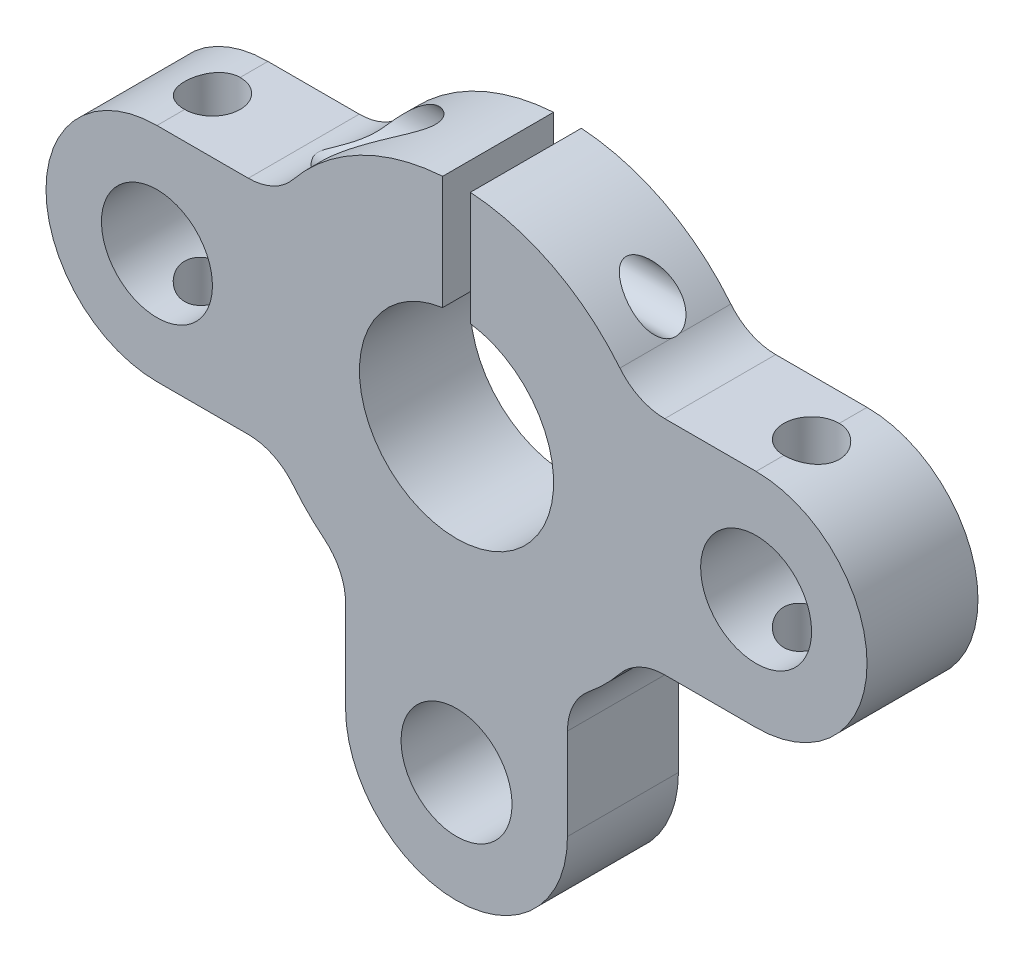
SolidWorks part; units mm, degrees
ref_plane "Front Plane" through (0, 0, 0) normal (0, 0, 1) x (1, 0, 0)
ref_plane "Top Plane" through (0, 0, 0) normal (0, 1, 0) x (1, 0, 0)
ref_plane "Right Plane" through (0, 0, 0) normal (1, 0, 0) x (0, 0, -1)
sketch "Sketch1" plane through (0, 0, 0) normal (0, 0, 1) x (1, 0, 0)
  circle A0 centre (0, 0) radius 11.1125
  circle A1 centre (0, 0) radius 24.0665
  dimension "D1" = 22.225
  dimension "D2" = 12.954
extrude "Boss-Extrude1" add sketch "Sketch1" along normal blind 12.7
sketch "Sketch2" plane through (0, 0, 12.7) normal (0, 0, 1) x (1, 0, 0)
  line L1 (-1.5875, 0) -> (1.5875, 0)
  line L2 (-1.5875, 0) -> (-1.5875, 25.4)
  line L3 (-1.5875, 25.4) -> (1.5875, 25.4)
  line L4 (1.5875, 0) -> (1.5875, 25.4)
  line L5 (-1.5875, 0) -> (1.5875, 25.4) construction
  line L6 (-1.5875, 25.4) -> (1.5875, 0) construction
  point P0 (0, 12.7)
  point P5 (0, 0)
  dimension "D1" = 3.175
  dimension "D2" = 25.4
extrude "Cut-Extrude1" cut sketch "Sketch2" against normal through all
sketch "Sketch7" plane through (0, 0, 0) normal (0, 0, -1) x (-1, 0, 0)
  line L0 (-12.7, -34.29) -> (-12.7, -20.4428)
  line L1 (12.7, -34.29) -> (12.7, -20.4428)
  circle A0 centre (0, 0) radius 34.29 construction
  circle A1 centre (0, -34.29) radius 6.35
  arc A2 (-12.7, -34.29) -> (12.7, -34.29) centre (0, -34.29) ccw
  arc A3 (-1.5875, 24.0141) -> (1.5875, 24.0141) centre (0, 0) ccw construction
  circle A5 centre (0, -34.29) radius 12.7 construction
  spline S0 degree 1 poles (-12.7, -20.4428) (12.7, -20.4428) knots 0 0 1 1
  point P15 (8.89, -30.1625)
  dimension "D1" = 68.58
  dimension "D2" = 12.7
  dimension "D3" = 6.35
extrude "Boss-Extrude4" add sketch "Sketch7" against normal blind 12.7
pattern_circular "CirPattern1" count 2 every 90 about axis through (0, 0, 0) along (0, 0, 1) of "Boss-Extrude4"
pattern_circular "CirPattern2" count 2 every 270 about axis through (0, 0, 0) along (0, 0, 1) of "CirPattern1"
sketch "Sketch8" plane through (0, 12.7, 0) normal (0, 1, 0) x (1, 0, 0)
  line L0 (34.29, -12.7) -> (34.29, 0) construction
  line L1 (20.4428, 0) -> (34.29, 0) construction
  line L2 (0, 0) -> (0, -17.7157) construction
  line L3 (0, -12.7) -> (0, 0) construction
  circle A0 centre (34.29, -6.35) radius 3.175
  circle A1 centre (-34.29, -6.35) radius 3.175
  dimension "D1" = 6.35
  dimension "D2" = 6.35
extrude "Cut-Extrude5" cut sketch "Sketch8" against normal through all
fillet "Fillet1" radius 6.604 6 edges at (-20.4428, 12.7, 6.35) (20.4428, 12.7, 6.35) (20.4428, -12.7, 6.35) (12.7, -20.4428, 6.35) (-20.4428, -12.7, 6.35) (-12.7, -20.4428, 6.35)
sketch "Sketch10" plane through (1.5875, 0, 0) normal (-1, 0, 0) x (0, 0, 1)
  line L0 (0, 24.0141) -> (0, 15.1474) construction
  line L1 (0, 24.0141) -> (12.7, 24.0141) construction
  point P0 (6.35, 17.6641)
  dimension "D1" = 6.35
  dimension "D2" = 6.35
hole_wizard "1/4-20 Tapped Hole1" positions "Sketch11" profile "Sketch12" tap size "1/4-20" standard "ANSI Inch"
sketch "Sketch11" plane through (1.5875, 0, 0) normal (-1, 0, 0) x (0, 0, 1)
  point P0 (6.35, 17.6641)
sketch "Sketch12" plane through (1.5875, 17.6641, 6.35) normal (0, 1, 0) x (0, 0, 1)
  line L0 (0, 0) -> (0, 45.4025)
  line L1 (0, 45.4025) -> (2.5527, 45.4025)
  line L2 (2.5527, 45.4025) -> (2.5527, 0)
  line L5 (2.5527, 0) -> (0, 0)
  line L11 (0, -6.35) -> (0, 107.95) construction
  dimension "Thru Tap Drill Dia." = 5.1054
  dimension "Thru Tap Drill Depth" = 45.4025
sketch "Sketch13" plane through (-1.5875, 0, 0) normal (1, 0, 0) x (0, 0, -1)
  circle A0 centre (-6.35, 17.6641) radius 3.175
  dimension "D1" = 6.35
extrude "Cut-Extrude6" cut sketch "Sketch13" against normal blind 2.54
sketch "Sketch16" plane through (-4.1275, 0, 0) normal (1, 0, 0) x (0, 0, -1)
  circle A0 centre (-6.35, 17.6641) radius 4.7625
  dimension "D1" = 9.525
extrude "Cut-Extrude7" cut sketch "Sketch16" against normal through all
